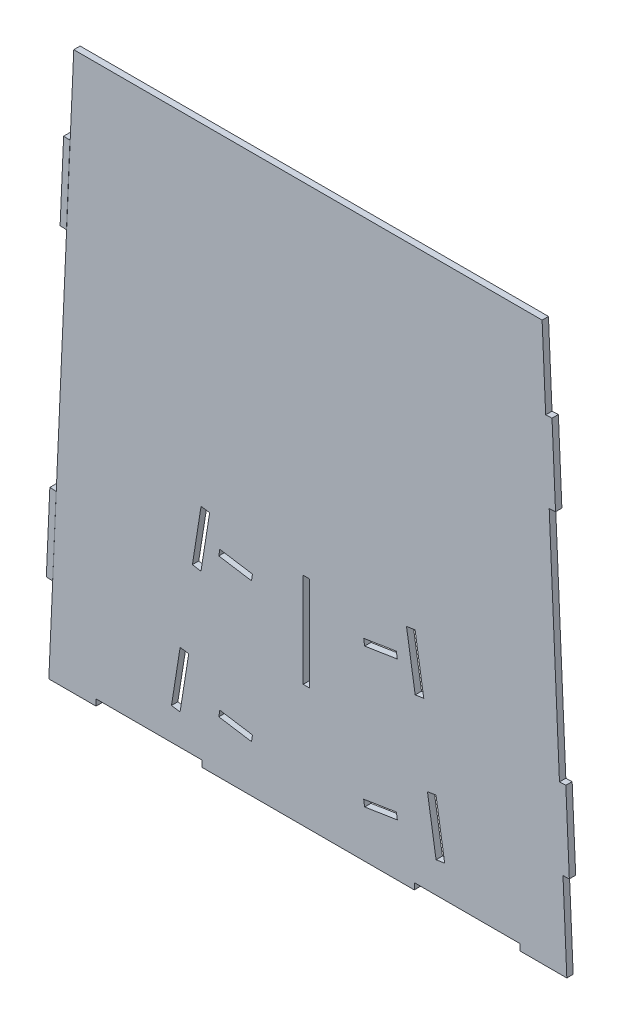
SolidWorks part; units mm, degrees
ref_plane "Front Plane" through (0, 0, 0) normal (0, 0, 1) x (1, 0, 0)
ref_plane "Top Plane" through (0, 0, 0) normal (0, 1, 0) x (1, 0, 0)
ref_plane "Right Plane" through (0, 0, 0) normal (1, 0, 0) x (0, 0, -1)
sketch "Sketch1" plane through (0, 0, 0) normal (0, 0, 1) x (1, 0, 0)
  line L0 (-62.1053, -13.2698) -> (-56.1208, 120.4303)
  line L1 (-56.1208, 120.4303) -> (56.213, 120.4303)
  line L2 (56.213, 120.4303) -> (62.1421, -13.2698)
  line L3 (62.1421, -13.2698) -> (-62.1053, -13.2698)
  line L4 (0.0184, -13.2698) -> (0.0184, -120.4303) construction
extrude "Boss-Extrude1" add sketch "Sketch1" along normal blind 1.524
sketch "Sketch2" plane through (0, 0, 1.524) normal (0, 0, 1) x (1, 0, 0)
  line L5 (0.0184, 111.4688) -> (0.0184, 198.9405) construction
  line L11 (-62.7047, 7.6127) -> (-61.8607, 26.644)
  line L14 (57.9108, 82.1443) -> (59.4333, 82.2119)
  line L15 (57.0668, 101.1756) -> (58.5893, 101.2431)
  line L16 (57.9108, 82.1443) -> (57.0668, 101.1756)
  line L17 (59.4333, 82.2119) -> (58.5893, 101.2431)
  line L19 (61.219, 7.5452) -> (62.7415, 7.6127)
  line L20 (60.375, 26.5765) -> (61.8975, 26.644)
  line L21 (61.219, 7.5452) -> (60.375, 26.5765)
  line L22 (62.7415, 7.6127) -> (61.8975, 26.644)
  line L23 (-61.1822, 7.5452) -> (-60.3382, 26.5765)
  line L24 (-60.3382, 26.5765) -> (-61.8607, 26.644)
  line L25 (-61.1822, 7.5452) -> (-62.7047, 7.6127)
  line L26 (-59.3965, 82.2119) -> (-58.5525, 101.2431)
  line L27 (-57.874, 82.1443) -> (-57.03, 101.1756)
  line L28 (-57.03, 101.1756) -> (-58.5525, 101.2431)
  line L29 (-57.874, 82.1443) -> (-59.3965, 82.2119)
extrude "Boss-Extrude2" add sketch "Sketch2" against normal blind 1.524
sketch "Sketch6" plane through (0, 0, 1.524) normal (0, 0, 1) x (1, 0, 0)
  line L1 (25.5473, -11.7458) -> (50.9473, -11.7458)
  line L2 (25.5473, -11.7458) -> (25.5473, -13.2698)
  line L3 (25.5473, -13.2698) -> (50.9473, -13.2698)
  line L4 (50.9473, -11.7458) -> (50.9473, -13.2698)
  line L5 (-50.791, -11.7458) -> (-25.391, -11.7458)
  line L6 (-50.791, -11.7458) -> (-50.791, -13.2698)
  line L7 (-50.791, -13.2698) -> (-25.391, -13.2698)
  line L8 (-25.391, -11.7458) -> (-25.391, -13.2698)
extrude "Cut-Extrude3" cut sketch "Sketch6" against normal blind 1.524
sketch "Sketch7" plane through (0, 0, 0) normal (0, 0, -1) x (-1, 0, 0)
  line L0 (25.5871, 40.8591) -> (27.6681, 27.6782)
  line L1 (23.6959, 52.8381) -> (33.8922, -11.7458) construction
  line L2 (30.61, 9.0441) -> (32.6789, -4.0608)
  line L3 (28.554, 8.7195) -> (30.6229, -4.3854)
  line L4 (23.5311, 40.5345) -> (25.6121, 27.3536)
  line L5 (32.6789, -4.0608) -> (30.6229, -4.3854)
  line L6 (28.554, 8.7195) -> (30.61, 9.0441)
  line L7 (-21.3709, 33.4141) -> (-13.5306, 32.1763) construction
  line L8 (25.5871, 40.8591) -> (23.5311, 40.5345)
  line L9 (27.6681, 27.6782) -> (25.6121, 27.3536)
  line L10 (-0.0781, 52.8381) -> (-0.0781, 98.3561) construction
  line L11 (-23.8521, 52.8381) -> (23.6959, 52.8381) construction
  line L12 (-30.7662, 9.0441) -> (-32.8351, -4.0608)
  line L13 (-25.7433, 40.8591) -> (-27.8243, 27.6782)
  line L14 (-27.8243, 27.6782) -> (-25.7682, 27.3536)
  line L15 (-25.7433, 40.8591) -> (-23.6873, 40.5345)
  line L16 (-0.4313, 38.77) -> (1.0927, 38.77)
  line L17 (-28.7102, 8.7195) -> (-30.7662, 9.0441)
  line L18 (-32.8351, -4.0608) -> (-30.7791, -4.3854)
  line L19 (-23.6873, 40.5345) -> (-25.7682, 27.3536)
  line L20 (-28.7102, 8.7195) -> (-30.7791, -4.3854)
  line L21 (-0.4313, 38.77) -> (-0.4313, 16.1111)
  line L22 (-0.4313, 16.1111) -> (1.0927, 16.1111)
  line L23 (1.0927, 38.77) -> (1.0927, 16.1111)
  line L24 (-0.4313, 38.77) -> (1.0927, 16.1111) construction
  line L25 (-0.4313, 16.1111) -> (1.0927, 38.77) construction
  line L26 (-21.3709, 0) -> (-13.5306, -1.2378) construction
  line L27 (-21.4898, 32.6614) -> (-13.6494, 31.4236)
  line L28 (-21.4898, -0.7527) -> (-13.6494, -1.9905)
  line L29 (-21.2521, 34.1668) -> (-13.4117, 32.929)
  line L30 (-21.2521, 0.7527) -> (-13.4117, -0.4851)
  line L31 (-21.4898, 32.6614) -> (-21.2521, 34.1668)
  line L32 (-13.6494, 31.4236) -> (-13.4117, 32.929)
  line L33 (-21.4898, -0.7527) -> (-21.2521, 0.7527)
  line L34 (-13.6494, -1.9905) -> (-13.4117, -0.4851)
  line L35 (21.2148, 0) -> (13.3744, -1.2378) construction
  line L36 (21.2148, 33.4141) -> (13.3744, 32.1763) construction
  line L37 (13.4932, -1.9905) -> (13.2555, -0.4851)
  line L38 (21.3336, -0.7527) -> (21.0959, 0.7527)
  line L39 (13.4932, 31.4236) -> (13.2555, 32.929)
  line L40 (21.3336, 32.6614) -> (21.0959, 34.1668)
  line L41 (21.0959, 0.7527) -> (13.2555, -0.4851)
  line L42 (21.0959, 34.1668) -> (13.2555, 32.929)
  line L43 (21.3336, -0.7527) -> (13.4932, -1.9905)
  line L44 (21.3336, 32.6614) -> (13.4932, 31.4236)
  point P20 (0.3307, 27.4406)
  dimension "D1" = 0.762
  dimension "D2" = 0.762
extrude "Cut-Extrude4" cut sketch "Sketch7" against normal blind 1.524
